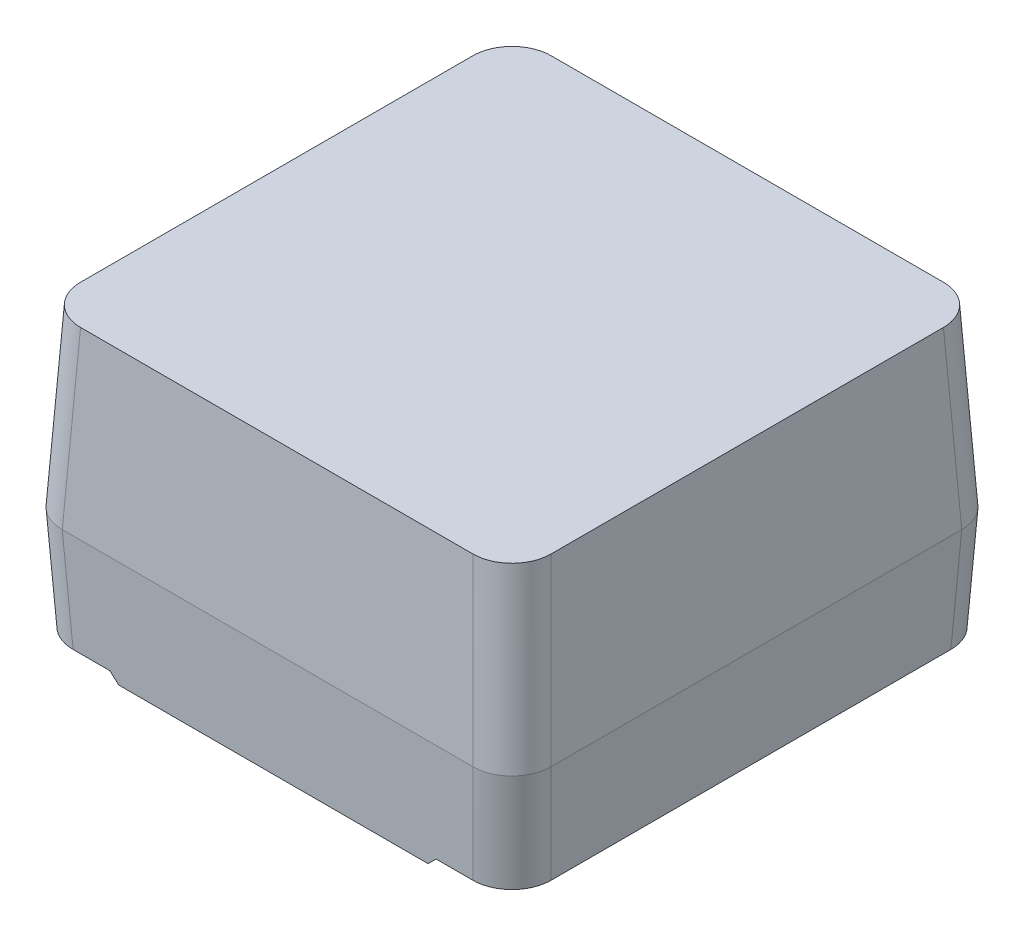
SolidWorks part; units mm, degrees
ref_plane "Front" through (0, 0, 0) normal (0, 0, 1) x (1, 0, 0)
ref_plane "Top" through (0, 0, 0) normal (0, 1, 0) x (1, 0, 0)
ref_plane "Right" through (0, 0, 0) normal (1, 0, 0) x (0, 0, -1)
sketch "Sketch1" plane through (0, 0, 0) normal (0, 1, 0) x (1, 0, 0)
  line L1 (5.1435, -5.1435) -> (-5.1435, -5.1435)
  line L2 (5.1435, -5.1435) -> (5.1435, 5.1435)
  line L3 (5.1435, 5.1435) -> (-5.1435, 5.1435)
  line L4 (-5.1435, -5.1435) -> (-5.1435, 5.1435)
  line L5 (5.1435, -5.1435) -> (-5.1435, 5.1435) construction
  line L6 (5.1435, 5.1435) -> (-5.1435, -5.1435) construction
  point P0 (0, 0)
  dimension "D1" = 10.287
  dimension "D2" = 10.287
extrude "Boss-Extrude1" add sketch "Sketch1" along normal blind 3.683 draft 3
sketch "Sketch2" plane through (0, 0, 0) normal (0, -1, 0) x (1, 0, 0)
  line L0 (5.1435, 5.1435) -> (5.1435, -5.1435) construction
  line L1 (-5.1435, 5.1435) -> (5.1435, 5.1435)
  line L2 (-5.1435, 5.1435) -> (-5.1435, -5.1435)
  line L3 (-5.1435, -5.1435) -> (5.1435, -5.1435)
  line L4 (5.1435, 5.1435) -> (5.1435, -5.1435)
  line L5 (-5.1435, 5.1435) -> (5.1435, -5.1435) construction
  line L6 (-5.1435, -5.1435) -> (5.1435, 5.1435) construction
  line L7 (5.1435, -5.1435) -> (-5.1435, -5.1435) construction
  point P0 (0, 0)
extrude "Boss-Extrude2" add sketch "Sketch2" along normal blind 2.3622 draft 3
fillet "Fillet1" radius 0.8255 8 edges at (5.0816, -1.1811, 5.0816) (5.047, 1.8415, 5.047) (-5.0816, -1.1811, 5.0816) (-5.047, 1.8415, 5.047) (-5.0816, -1.1811, -5.0816) (-5.047, 1.8415, -5.047) (5.0816, -1.1811, -5.0816) (5.047, 1.8415, -5.047)
sketch "Sketch3" plane through (0, -2.3622, 0) normal (0, -1, 0) x (1, 0, 0)
  line L0 (0, 5.0197) -> (0, -5.0197) construction
  line L1 (4.1953, 5.0197) -> (-4.1953, 5.0197) construction
  line L2 (-4.1953, -5.0197) -> (4.1953, -5.0197) construction
  line L3 (-5.0197, 0) -> (5.0197, 0) construction
  line L4 (-5.0197, 4.1953) -> (-5.0197, -4.1953) construction
  line L5 (5.0197, -4.1953) -> (5.0197, 4.1953) construction
  line L6 (3.4322, 6.35) -> (6.6072, -6.35) construction
  line L7 (-3.4322, -6.35) -> (-6.6072, -6.35)
  line L8 (-3.4322, -6.35) -> (-3.4322, 6.35)
  line L9 (-3.4322, 6.35) -> (-6.6072, 6.35)
  line L10 (-6.6072, -6.35) -> (-6.6072, 6.35)
  line L11 (-3.4322, -6.35) -> (-6.6072, 6.35) construction
  line L12 (-3.4322, 6.35) -> (-6.6072, -6.35) construction
  line L13 (3.4322, -6.35) -> (6.6072, 6.35) construction
  line L14 (6.6072, -6.35) -> (6.6072, 6.35)
  line L15 (3.4322, 6.35) -> (6.6072, 6.35)
  line L16 (3.4322, -6.35) -> (3.4322, 6.35)
  line L17 (3.4322, -6.35) -> (6.6072, -6.35)
  dimension "D1" = 12.7
  dimension "D2" = 3.175
extrude "Cut-Extrude1" cut sketch "Sketch3" against normal blind 0.1778
chamfer "Chamfer1" distance 0.1778 angle 45 2 edges at (3.4322, -2.3622, 0) (-3.4322, -2.3622, 0)
